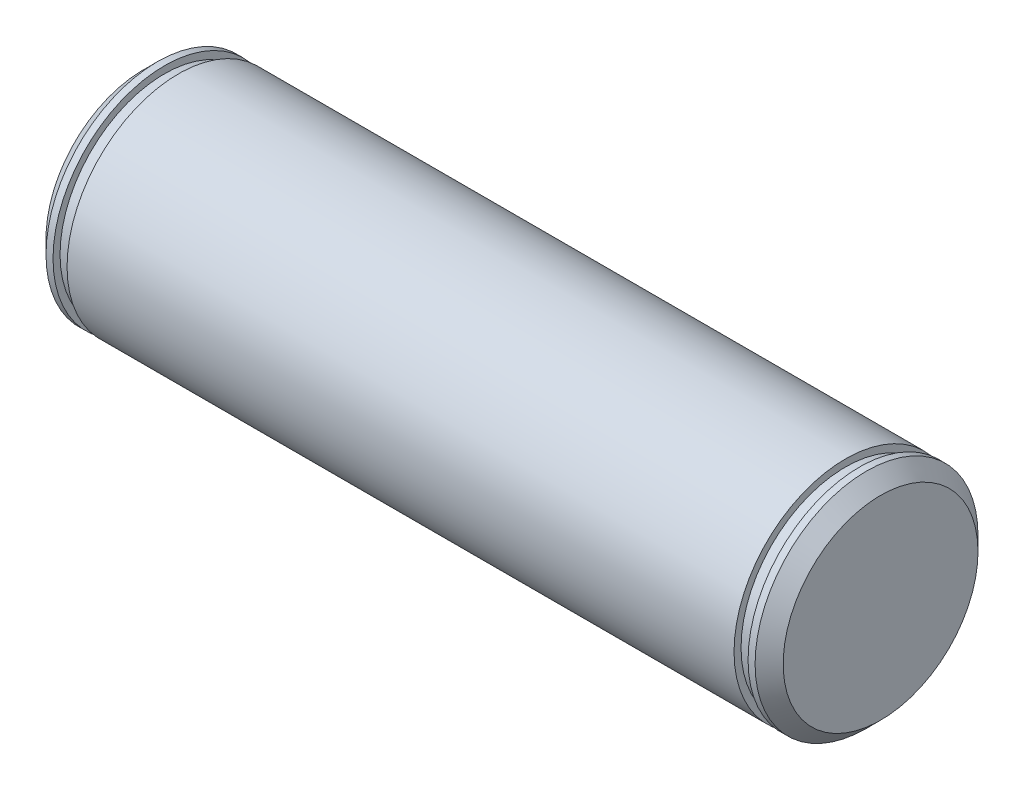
SolidWorks part; units mm, degrees
ref_plane "Front Plane" through (0, 0, 0) normal (0, 0, 1) x (1, 0, 0)
ref_plane "Top Plane" through (0, 0, 0) normal (0, 1, 0) x (1, 0, 0)
ref_plane "Right Plane" through (0, 0, 0) normal (1, 0, 0) x (0, 0, -1)
sketch "Sketch1" plane through (0, 0, 0) normal (1, 0, 0) x (0, 0, -1)
  circle A0 centre (0, 0) radius 15.875
  dimension "D1" = 31.75
extrude "Boss-Extrude1" add sketch "Sketch1" along normal mid plane 105
chamfer "Chamfer1" distance 2 angle 45 2 edges at (-52.5, 0, -15.875) (52.5, 0, -15.875)
ref_plane "Plane1" through (-47.5, 0, 0) normal (-1, 0, 0) x (0, 0, 1)
sketch "Sketch2" plane through (-47.5, 0, 0) normal (-1, 0, 0) x (0, 0, 1)
  circle A0 centre (0, 0) radius 14.875
  circle A1 centre (0, 0) radius 15.875
  dimension "D1" = 29.75
  dimension "D2" = 31.75
extrude "Cut-Extrude1" cut sketch "Sketch2" along normal blind 2
mirror "Mirror1" about plane through (0, 0, 0) normal (1, 0, 0) of "Cut-Extrude1"
